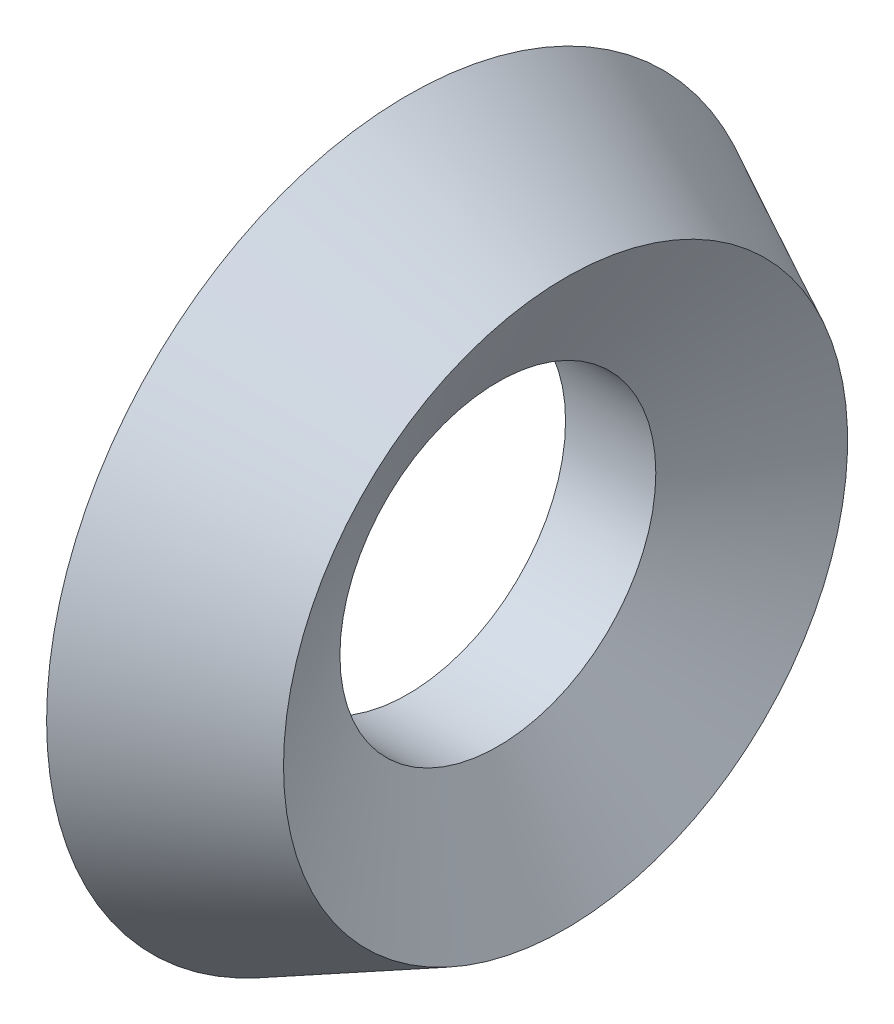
SolidWorks part; units mm, degrees
ref_plane "Plan1" through (0, 0, 0) normal (0, 0, 1) x (1, 0, 0)
ref_plane "Plan2" through (0, 0, 0) normal (0, 1, 0) x (1, 0, 0)
ref_plane "Plan3" through (0, 0, 0) normal (1, 0, 0) x (0, 0, -1)
sketch "Esquisse1" plane through (0, 0, 0) normal (0, 0, 1) x (1, 0, 0)
  line L0 (-10, 0) -> (9, 0) construction
  line L1 (0, 3.5) -> (0, 8)
  line L2 (0, 8) -> (3.5, 6.25)
  line L3 (3.5, 6.25) -> (2, 3.5)
  line L4 (2, 3.5) -> (0, 3.5)
  dimension "D1" = 3.5
  dimension "D2" = 6.25
  dimension "D3" = 8
  dimension "D4" = 3.5
  dimension "D5" = 2
revolve "Base-Révolution" add sketch "Esquisse1" angle 360 about L0
